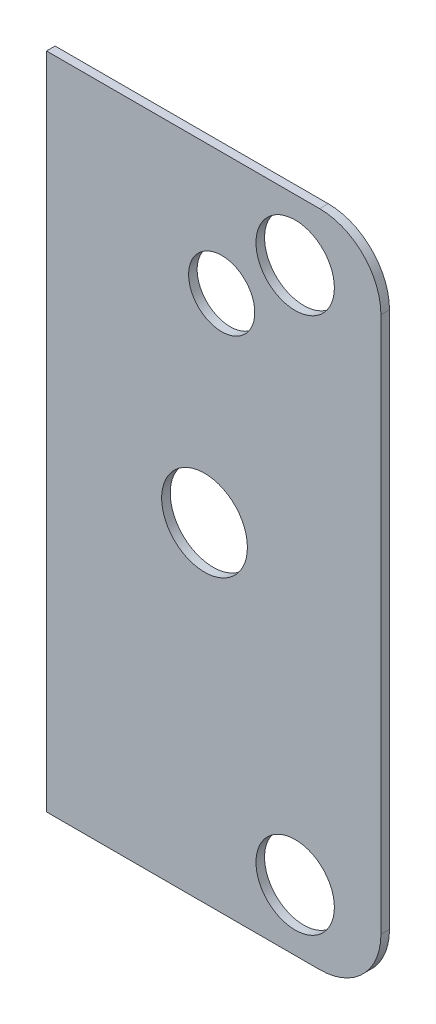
SolidWorks part; units mm, degrees
other "標示1"
sketch "草圖39" plane through (-15.25, -26.9, 0.5) normal (-0.0155, -0.7289, 0.6844) x (0.9982, -0.0506, -0.0312)
ref_plane "前基準面" through (0, 0, 0) normal (0, 0, 1) x (1, 0, 0)
ref_plane "上基準面" through (0, 0, 0) normal (0, 1, 0) x (1, 0, 0)
ref_plane "右基準面" through (0, 0, 0) normal (1, 0, 0) x (0, 0, -1)
sketch "草圖1" plane through (0, 0, 0) normal (0, 0, 1) x (1, 0, 0)
  line L1 (-38, 30) -> (38, 30)
  line L2 (-38, 30) -> (-38, -30)
  line L3 (-38, -30) -> (38, -30)
  line L4 (38, 30) -> (38, -30)
  line L5 (-38, 30) -> (38, -30) construction
  line L6 (-38, -30) -> (38, 30) construction
  point P0 (0, 0)
  point P28 (0, 0)
  dimension "D1" = 76
  dimension "D2" = 60
extrude "填料-伸長1" add sketch "草圖1" along normal blind 0.7
sketch "草圖5" plane through (0, 0, 0.7) normal (0, 0, 1) x (1, 0, 0)
  line L0 (-29.9, 26.9) -> (29.9, 26.9)
  line L1 (-38, 30) -> (-38, -30) construction
  line L2 (38, -30) -> (38, 30) construction
  line L3 (34.9, 21.9) -> (34.9, -21.9)
  line L4 (38, 30) -> (-38, 30) construction
  line L5 (-38, -30) -> (38, -30) construction
  line L6 (-29.9, -26.9) -> (29.9, -26.9)
  line L7 (-34.9, 21.9) -> (-34.9, -21.9)
  arc A0 (-29.9, -26.9) -> (-34.9, -21.9) centre (-29.9, -21.9) cw
  arc A1 (34.9, -21.9) -> (29.9, -26.9) centre (29.9, -21.9) cw
  arc A2 (29.9, 26.9) -> (34.9, 21.9) centre (29.9, 21.9) cw
  arc A3 (-34.9, 21.9) -> (-29.9, 26.9) centre (-29.9, 21.9) cw
  dimension "D5" = 5
  dimension "D1" = 3.1
  dimension "D2" = 3.1
  dimension "D3" = 3.1
  dimension "D4" = 3.1
extrude "除料-伸長4" cut sketch "草圖5" against normal blind 10 contours L7 A3 L0 A2 L3 A1 L6 A0 M32 M29 M30 M31
ref_plane "平面1" through (0, 0, 0.7) normal (0, 0, 1) x (1, 0, 0)
sketch "草圖9" plane through (0, 0, 0.7) normal (0, 0, 1) x (1, 0, 0)
  line L0 (34.9, 21.9) -> (24.9, 21.9) construction
  line L1 (24.9, 21.9) -> (24.9, -21.9) construction
  line L2 (24.9, -21.9) -> (34.9, -21.9) construction
  line L3 (34.9, 21.9) -> (34.9, -21.9) construction
  line L4 (0, 26.9) -> (0, -26.9) construction
  line L5 (-29.9, 26.9) -> (29.9, 26.9) construction
  line L6 (-29.9, -26.9) -> (29.9, -26.9) construction
  line L7 (34.9, 0) -> (-34.9, 0) construction
  line L8 (-34.9, 21.9) -> (-34.9, -21.9) construction
  circle A0 centre (32.1, 17.9) radius 1.5
  circle A3 centre (-32.1, 19.4) radius 1.5
  circle A4 centre (-32.1, -19.4) radius 1.5
  circle A5 centre (32.1, -19.4) radius 1.5
  dimension "D2" = 3
  dimension "D5" = 2.8
  dimension "D3" = 3
  dimension "D7" = 2.8
  dimension "D1" = 10
  dimension "D4" = 4
  dimension "D6" = 2.5
sketch "草圖13" plane through (0, 0, 0.7) normal (0, 0, 1) x (1, 0, 0)
  line L0 (5.358, 0.6292) -> (19.0478, 4.7845) construction
  line L1 (0.3574, 0.005) -> (20.1903, 2.4807) construction
  line L2 (20.1903, -2.4807) -> (0.3574, -0.005) construction
  line L15 (0.3574, 0.005) -> (5.358, 0.6292) construction
  line L16 (0.3574, -0.005) -> (5.358, -0.6292) construction
  line L17 (5.358, -0.6292) -> (19.0478, -4.7845) construction
  line L18 (-2.1341, -4.9548) -> (-5.3804, -18.8881) construction
  line L19 (-0.1744, -0.312) -> (-2.1341, -4.9548) construction
  line L20 (-0.183, -0.307) -> (-3.2239, -4.3256) construction
  line L21 (-3.2239, -4.3256) -> (-13.6673, -14.1036) construction
  line L22 (-3.2239, 4.3256) -> (-13.6673, 14.1036) construction
  line L23 (-0.183, 0.307) -> (-3.2239, 4.3256) construction
  line L24 (-0.1744, 0.312) -> (-2.1341, 4.9548) construction
  line L25 (-2.1341, 4.9548) -> (-5.3804, 18.8881) construction
  line L41 (0.3574, 0.005) -> (6.1962, 1.0512)
  line L42 (0.3574, -0.005) -> (6.1962, -1.0512)
  line L43 (-0.183, -0.307) -> (-4.0085, -4.8405)
  line L44 (-0.1744, -0.312) -> (-2.1877, -5.8917)
  line L45 (-0.1744, 0.312) -> (-2.1877, 5.8917)
  line L46 (-0.183, 0.307) -> (-4.0085, 4.8405)
  circle A8 centre (0, 0) radius 0.353 construction
  arc A9 (0.3574, 0.005) -> (0.3574, -0.005) centre (0.358, 0) ccw construction
  circle A10 centre (20.5, 0) radius 2.5 construction
  arc A11 (19.0478, -4.7845) -> (19.0478, 4.7845) centre (20.5, 0) ccw construction
  arc A12 (-13.6673, -14.1036) -> (-5.3804, -18.8881) centre (-10.25, -17.7535) ccw construction
  arc A13 (-0.1744, -0.312) -> (-0.183, -0.307) centre (-0.179, -0.31) ccw construction
  arc A14 (-5.3804, 18.8881) -> (-13.6673, 14.1036) centre (-10.25, 17.7535) ccw construction
  arc A15 (-0.183, 0.307) -> (-0.1744, 0.312) centre (-0.179, 0.31) ccw construction
  arc A16 (-4.7391, 4.8766) -> (-4.7391, -4.8766) centre (0, 0) ccw
  arc A17 (-0.183, 0.307) -> (-0.1744, 0.312) centre (-0.179, 0.31) ccw
  arc A18 (-0.1744, -0.312) -> (-0.183, -0.307) centre (-0.179, -0.31) ccw
  arc A19 (-1.8537, -6.5425) -> (6.5928, -1.6658) centre (0, 0) ccw
  arc A20 (0.3574, 0.005) -> (0.3574, -0.005) centre (0.358, 0) ccw
  arc A21 (6.5928, 1.6658) -> (-1.8537, 6.5425) centre (0, 0) ccw
  arc A22 (6.1962, -1.0512) -> (6.5928, -1.6658) centre (6.108, -1.5434) cw
  arc A23 (6.1962, 1.0512) -> (6.5928, 1.6658) centre (6.108, 1.5434) ccw
  arc A24 (-2.1877, 5.8917) -> (-1.8537, 6.5425) centre (-1.7174, 6.0614) cw
  arc A25 (-4.0085, 4.8405) -> (-4.7391, 4.8766) centre (-4.3906, 4.518) ccw
  arc A26 (-4.0085, -4.8405) -> (-4.7391, -4.8766) centre (-4.3906, -4.518) cw
  arc A27 (-2.1877, -5.8917) -> (-1.8537, -6.5425) centre (-1.7174, -6.0614) ccw
  point P31 (0, 0)
  point P38 (6.7034, -1.1421)
  point P41 (6.7034, 1.1421)
  point P49 (0, 0)
  dimension "D1" = 0.706
  dimension "D2" = 0.01
  dimension "D3" = 5
  dimension "D6" = 5
  dimension "D5" = 10
  dimension "D8" = 13.6
  dimension "D12" = 0.5
  dimension "D13" = 0.5
  dimension "D4" = 20.5
  dimension "D9" = 0.1
  dimension "D10" = 0.1
  dimension "D11" = 3
  dimension "D7" = 3
extrude "除料-伸長8" cut sketch "草圖13" against normal blind 0.7
sketch "草圖17" plane through (0, 0, 0.7) normal (0, 0, 1) x (1, 0, 0)
  line L0 (-29.9, 26.9) -> (29.9, 26.9) construction
  line L1 (-34.9, 21.9) -> (-34.9, -21.9) construction
  line L2 (0, 26.9) -> (0, -26.9) construction
  line L3 (-29.9, -26.9) -> (29.9, -26.9) construction
  circle A0 centre (-21.9, 16.9) radius 2.5
  circle A1 centre (21.9, 16.9) radius 2.5
  circle A2 centre (-21.9, -19.4) radius 2.5
  dimension "D3" = 5
  dimension "D4" = 5
  dimension "D1" = 10
  dimension "D2" = 13
  dimension "D5" = 7.5
extrude "除料-伸長9" cut sketch "草圖17" against normal through all
sketch "草圖20" plane through (0, 0, 0.7) normal (0, 0, 1) x (1, 0, 0)
  line L0 (20.1903, 2.4807) -> (0.3574, 0.005) construction
  line L1 (0.3574, -0.005) -> (20.1903, -2.4807) construction
  line L2 (0.3574, 0.005) -> (5.358, 0.6292)
  line L3 (0.3574, -0.005) -> (5.358, -0.6292)
  line L4 (5.358, 0.6292) -> (19.0478, 4.7845)
  line L5 (5.358, -0.6292) -> (19.0478, -4.7845)
  line L6 (-0.183, -0.307) -> (-3.2239, -4.3256)
  line L7 (-3.2239, -4.3256) -> (-13.6673, -14.1036)
  line L8 (-2.1341, -4.9548) -> (-5.3804, -18.8881)
  line L9 (-0.1744, -0.312) -> (-2.1341, -4.9548)
  line L10 (-7.9468, -18.7257) -> (-0.1744, -0.312) construction
  line L11 (-0.183, -0.307) -> (-12.2436, -16.245) construction
  line L12 (-0.1744, 0.312) -> (-2.1341, 4.9548)
  line L13 (-2.1341, 4.9548) -> (-5.3804, 18.8881)
  line L14 (-3.2239, 4.3256) -> (-13.6673, 14.1036)
  line L15 (-0.183, 0.307) -> (-3.2239, 4.3256)
  line L16 (-12.2436, 16.245) -> (-0.183, 0.307) construction
  line L17 (-0.1744, 0.312) -> (-7.9468, 18.7257) construction
  circle A0 centre (0, 0) radius 0.353 construction
  arc A1 (0.3574, 0.005) -> (0.3574, -0.005) centre (0.358, 0) ccw
  circle A2 centre (20.5, 0) radius 2.5 construction
  arc A3 (19.0478, -4.7845) -> (19.0478, 4.7845) centre (20.5, 0) ccw
  arc A4 (-0.1744, -0.312) -> (-0.183, -0.307) centre (-0.179, -0.31) ccw
  arc A5 (-13.6673, -14.1036) -> (-5.3804, -18.8881) centre (-10.25, -17.7535) ccw
  circle A6 centre (-10.25, -17.7535) radius 2.5 construction
  arc A7 (-0.183, 0.307) -> (-0.1744, 0.312) centre (-0.179, 0.31) ccw
  arc A8 (-5.3804, 18.8881) -> (-13.6673, 14.1036) centre (-10.25, 17.7535) ccw
  circle A9 centre (-10.25, 17.7535) radius 2.5 construction
  point P38 (0, 0)
  dimension "D1" = 0.706
  dimension "D2" = 0.01
  dimension "D3" = 5
  dimension "D5" = 10
  dimension "D4" = 20.5
  dimension "D6" = 5
  dimension "D7" = 3
ref_plane "平面5" through (0, 0, 0.7) normal (0, 0, 1) x (1, 0, 0)
sketch "草圖29" plane through (0, 0, 0.7) normal (0, 0, 1) x (1, 0, 0)
  line L0 (0, 26.9) -> (0, -26.9) construction
  line L1 (-29.9, 26.9) -> (29.9, 26.9) construction
  line L2 (-29.9, -26.9) -> (29.9, -26.9) construction
  line L3 (-34.9, 0) -> (34.9, 0) construction
  line L4 (-34.9, 21.9) -> (-34.9, -21.9) construction
  line L5 (34.9, 21.9) -> (34.9, -21.9) construction
  circle A0 centre (-27.9, 21.9) radius 3
  circle A1 centre (27.9, 21.9) radius 3
  circle A2 centre (27.9, -21.9) radius 3
  circle A3 centre (-27.9, -21.9) radius 3
  dimension "D1" = 6
  dimension "D2" = 5
  dimension "D3" = 7
extrude "填料-伸長3" add sketch "草圖29" along normal blind 0.6
sketch "草圖31" plane through (0, 0, 0.7) normal (0, 0, 1) x (1, 0, 0)
  line L3 (2.5, 40) -> (-2.5, 40)
  line L5 (-5, 37.5) -> (-5, -37.5)
  line L6 (2.5, -40) -> (-2.5, -40)
  line L10 (5, 37.5) -> (5, -37.5)
  line L18 (0, 0) -> (0.353, 0)
  line L20 (-5, 0) -> (5, 0)
  arc A1 (-2.5, 40) -> (-5, 37.5) centre (-2.5, 37.5) ccw
  arc A2 (-5, -37.5) -> (-2.5, -40) centre (-2.5, -37.5) ccw
  arc A3 (5, -37.5) -> (2.5, -40) centre (2.5, -37.5) cw
  arc A9 (2.5, 40) -> (5, 37.5) centre (2.5, 37.5) cw
  arc A10 (0.3574, 0.005) -> (0.3574, -0.005) centre (0.358, 0) ccw construction
extrude "除料-伸長18" cut sketch "草圖31" against normal mid plane 10 contours A9 L3 A1 L5 L10 M56 | L10 L5 M56 M36 M37 M38 M39 M40 M41 M42 | L5 L20 L18 L10 M27 M44 M42 M41 M40 M39 M38 M37 M36 | L10 L5 M30 M31 M32 M33 M34 M35 M36 M52 | L20 L5 L10 L18 M36 M35 M34 M33 M32 M31 M30 M28 M27 | A3 L10 L5 A2 L6 M52
sketch "草圖34" plane through (0, 0, 0.7) normal (0, 0, 1) x (1, 0, 0)
  circle A1 centre (20.5, 0) radius 3.5
  circle A2 centre (-10.25, 17.7535) radius 3
  circle A3 centre (-10.25, -17.7535) radius 3
  dimension "D1" = 7
  dimension "D2" = 6
  dimension "D3" = 6
sketch "草圖35" plane through (0, 0, 0.7) normal (0, 0, 1) x (1, 0, 0)
  circle A0 centre (21.9, 16.9) radius 2.7
  dimension "D1" = 5.4
sketch "草圖37" plane through (0, 0, 0.7) normal (0, 0, 1) x (1, 0, 0)
  line L5 (5, 26.9) -> (5, 4.6087)
  line L6 (5, 26.9) -> (5, 4.6087)
  line L9 (34.9, -21.9) -> (34.9, 21.9)
  line L11 (5, -26.9) -> (29.9, -26.9)
  line L12 (34.9, -21.9) -> (34.9, 21.9)
  line L13 (29.9, 26.9) -> (5, 26.9)
  line L18 (5, -26.9) -> (29.9, -26.9)
  line L19 (34.9, -21.9) -> (34.9, 21.9)
  line L20 (29.9, 26.9) -> (5, 26.9)
  line L22 (34.9, -21.9) -> (34.9, 21.9)
  line L26 (5, 26.9) -> (5, 4.6087)
  line L27 (5, 26.9) -> (5, 4.6087)
  line L28 (6.1962, 1.0512) -> (0.3574, 0.005)
  line L36 (6.1962, 1.0512) -> (0.3574, 0.005)
  line L45 (6.1962, 1.0512) -> (0.3574, 0.005)
  line L47 (6.1962, 1.0512) -> (0.3574, 0.005)
  line L48 (0.3574, -0.005) -> (6.1962, -1.0512)
  line L49 (0.3574, -0.005) -> (6.1962, -1.0512)
  line L50 (5, -4.6087) -> (5, -26.9)
  line L51 (5, -4.6087) -> (5, -26.9)
  line L52 (0.3574, -0.005) -> (6.1962, -1.0512)
  line L53 (0.3574, -0.005) -> (6.1962, -1.0512)
  line L54 (5, -4.6087) -> (5, -26.9)
  line L55 (5, -4.6087) -> (5, -26.9)
  line L56 (29.9, 26.9) -> (5, 26.9)
  line L57 (29.9, 26.9) -> (5, 26.9)
  line L58 (5, -26.9) -> (29.9, -26.9)
  line L59 (5, -26.9) -> (29.9, -26.9)
  arc A3 (6.5928, 1.6658) -> (5, 4.6087) centre (0, 0) ccw
  arc A5 (29.9, -26.9) -> (34.9, -21.9) centre (29.9, -21.9) ccw
  arc A8 (29.9, -26.9) -> (34.9, -21.9) centre (29.9, -21.9) ccw
  arc A9 (34.9, 21.9) -> (29.9, 26.9) centre (29.9, 21.9) ccw
  arc A13 (29.9, -26.9) -> (34.9, -21.9) centre (29.9, -21.9) ccw
  arc A14 (34.9, 21.9) -> (29.9, 26.9) centre (29.9, 21.9) ccw
  arc A17 (6.5928, 1.6658) -> (5, 4.6087) centre (0, 0) ccw
  arc A18 (6.1962, 1.0512) -> (6.5928, 1.6658) centre (6.108, 1.5434) ccw
  arc A20 (6.1962, 1.0512) -> (6.5928, 1.6658) centre (6.108, 1.5434) ccw
  arc A22 (6.5928, 1.6658) -> (5, 4.6087) centre (0, 0) ccw
  arc A23 (6.5928, 1.6658) -> (5, 4.6087) centre (0, 0) ccw
  arc A32 (29.9, -26.9) -> (34.9, -21.9) centre (29.9, -21.9) ccw
  arc A33 (34.9, 21.9) -> (29.9, 26.9) centre (29.9, 21.9) ccw
  arc A35 (34.9, 21.9) -> (29.9, 26.9) centre (29.9, 21.9) ccw
  arc A36 (6.1962, 1.0512) -> (6.5928, 1.6658) centre (6.108, 1.5434) ccw
  arc A37 (6.1962, 1.0512) -> (6.5928, 1.6658) centre (6.108, 1.5434) ccw
  arc A41 (0.3574, 0.005) -> (0.3574, -0.005) centre (0.358, 0) ccw
  arc A42 (0.3574, 0.005) -> (0.3574, -0.005) centre (0.358, 0) ccw
  arc A43 (6.5928, -1.6658) -> (6.1962, -1.0512) centre (6.108, -1.5434) ccw
  arc A44 (6.5928, -1.6658) -> (6.1962, -1.0512) centre (6.108, -1.5434) ccw
  arc A45 (5, -4.6087) -> (6.5928, -1.6658) centre (0, 0) ccw
  arc A46 (5, -4.6087) -> (6.5928, -1.6658) centre (0, 0) ccw
  arc A47 (0.3574, 0.005) -> (0.3574, -0.005) centre (0.358, 0) ccw
  arc A48 (0.3574, 0.005) -> (0.3574, -0.005) centre (0.358, 0) ccw
  arc A49 (6.5928, -1.6658) -> (6.1962, -1.0512) centre (6.108, -1.5434) ccw
  arc A50 (6.5928, -1.6658) -> (6.1962, -1.0512) centre (6.108, -1.5434) ccw
  arc A51 (5, -4.6087) -> (6.5928, -1.6658) centre (0, 0) ccw
  arc A52 (5, -4.6087) -> (6.5928, -1.6658) centre (0, 0) ccw
  dimension "D1" = 0
  dimension "D2" = 0
extrude "除料-伸長31" cut sketch "草圖34" against normal blind 10
sketch "草圖41" plane through (0, 0, 0.7) normal (0, 0, 1) x (1, 0, 0)
  line L5 (-5, 4.6087) -> (-5, 26.9)
  line L6 (-5, 26.9) -> (-29.9, 26.9)
  line L7 (-34.9, 21.9) -> (-34.9, -21.9)
  line L8 (-29.9, -26.9) -> (-5, -26.9)
  line L9 (-5, -26.9) -> (-5, -4.6087)
  line L10 (-5, 4.6087) -> (-5, 26.9)
  line L11 (-5, 26.9) -> (-29.9, 26.9)
  line L12 (-34.9, 21.9) -> (-34.9, -21.9)
  line L13 (-29.9, -26.9) -> (-5, -26.9)
  line L14 (-5, -26.9) -> (-5, -4.6087)
  arc A3 (-29.9, 26.9) -> (-34.9, 21.9) centre (-29.9, 21.9) ccw
  arc A4 (-34.9, -21.9) -> (-29.9, -26.9) centre (-29.9, -21.9) ccw
  arc A5 (-5, 4.6087) -> (-5, -4.6087) centre (0, 0) ccw
  arc A6 (-29.9, 26.9) -> (-34.9, 21.9) centre (-29.9, 21.9) ccw
  arc A7 (-34.9, -21.9) -> (-29.9, -26.9) centre (-29.9, -21.9) ccw
  arc A8 (-5, 4.6087) -> (-5, -4.6087) centre (0, 0) ccw
  dimension "D1" = 0
extrude "除料-伸長34" cut sketch "草圖41" against normal blind 10
sketch "草圖42" plane through (0, 0, 1.3) normal (0, 0, 1) x (1, 0, 0)
  circle A0 centre (27.9, 21.9) radius 3.2
  circle A1 centre (27.9, -21.9) radius 3.2
  circle A2 centre (-27.9, 21.9) radius 3.1
  circle A3 centre (-27.9, -21.9) radius 3.1
  dimension "D1" = 6.4
  dimension "D2" = 6.4
  dimension "D3" = 6.2
  dimension "D4" = 6.2
extrude "除料-伸長35" cut sketch "草圖42" against normal blind 10 contours A2 | A3 | A0 | A1
sketch "草圖43" plane through (0, 0, 0.7) normal (0, 0, 1) x (1, 0, 0)
  line L1 (7.6, 26.9) -> (7.6, 4.6087)
  line L2 (7.6, 4.6087) -> (7.6, -4.6087)
  line L3 (7.6, -4.6087) -> (7.6, -26.9)
  line L7 (29.9, 26.9) -> (5, 26.9)
  line L8 (5, 26.9) -> (5, 4.6087)
  line L9 (6.1962, 1.0512) -> (0.3574, 0.005)
  line L10 (0.3574, -0.005) -> (6.1962, -1.0512)
  line L11 (5, -4.6087) -> (5, -26.9)
  line L12 (5, -26.9) -> (29.9, -26.9)
  line L13 (34.9, -21.9) -> (34.9, 21.9)
  line L14 (29.9, 26.9) -> (5, 26.9)
  line L15 (5, 26.9) -> (5, 4.6087)
  line L16 (6.1962, 1.0512) -> (0.3574, 0.005)
  line L17 (0.3574, -0.005) -> (6.1962, -1.0512)
  line L18 (5, -4.6087) -> (5, -26.9)
  line L19 (5, -26.9) -> (29.9, -26.9)
  line L20 (34.9, -21.9) -> (34.9, 21.9)
  line L25 (5, 4.6087) -> (5, -4.6087) construction
  arc A7 (6.5928, 1.6658) -> (5, 4.6087) centre (0, 0) ccw
  arc A8 (6.1962, 1.0512) -> (6.5928, 1.6658) centre (6.108, 1.5434) ccw
  arc A9 (0.3574, 0.005) -> (0.3574, -0.005) centre (0.358, 0) ccw
  arc A10 (6.5928, -1.6658) -> (6.1962, -1.0512) centre (6.108, -1.5434) ccw
  arc A11 (5, -4.6087) -> (6.5928, -1.6658) centre (0, 0) ccw
  arc A12 (29.9, -26.9) -> (34.9, -21.9) centre (29.9, -21.9) ccw
  arc A13 (34.9, 21.9) -> (29.9, 26.9) centre (29.9, 21.9) ccw
  arc A14 (6.5928, 1.6658) -> (5, 4.6087) centre (0, 0) ccw
  arc A15 (6.1962, 1.0512) -> (6.5928, 1.6658) centre (6.108, 1.5434) ccw
  arc A16 (0.3574, 0.005) -> (0.3574, -0.005) centre (0.358, 0) ccw
  arc A17 (6.5928, -1.6658) -> (6.1962, -1.0512) centre (6.108, -1.5434) ccw
  arc A18 (5, -4.6087) -> (6.5928, -1.6658) centre (0, 0) ccw
  arc A19 (29.9, -26.9) -> (34.9, -21.9) centre (29.9, -21.9) ccw
  arc A20 (34.9, 21.9) -> (29.9, 26.9) centre (29.9, 21.9) ccw
  dimension "D1" = 0
  dimension "D2" = 2.6
extrude "除料-伸長36" cut sketch "草圖43" against normal blind 10
sketch "草圖44" plane through (0, 0, 1.3) normal (0, 0, 1) x (1, 0, 0)
  circle A0 centre (-27.9, 21.9) radius 3
  circle A1 centre (-27.9, -21.9) radius 3
extrude "除料-伸長37" cut sketch "草圖44" against normal blind 10
extrude "除料-伸長38" cut sketch "草圖35" against normal through all
extrude "除料-伸長39" cut sketch "草圖45" against normal blind 0.5
sketch "草圖45" [suppressed] plane through (0, 0, 0) normal (0, 0, -1) x (-1, 0, 0)
  circle A3 centre (26.6, 0) radius 1.1
  circle A4 centre (20.5, -6.1) radius 1.1
  circle A5 centre (20.5, 6.1) radius 1.1
  circle A8 centre (-10.67, 23.8535) radius 1.1
  circle A9 centre (-16.2412, 18.9005) radius 1.1
  circle A10 centre (-10.6517, 9.7731) radius 1.1
  circle A11 centre (-10.67, -23.8535) radius 1.1
  circle A12 centre (-16.2412, -18.9005) radius 1.1
  circle A13 centre (-13.5886, -12.523) radius 1.1
